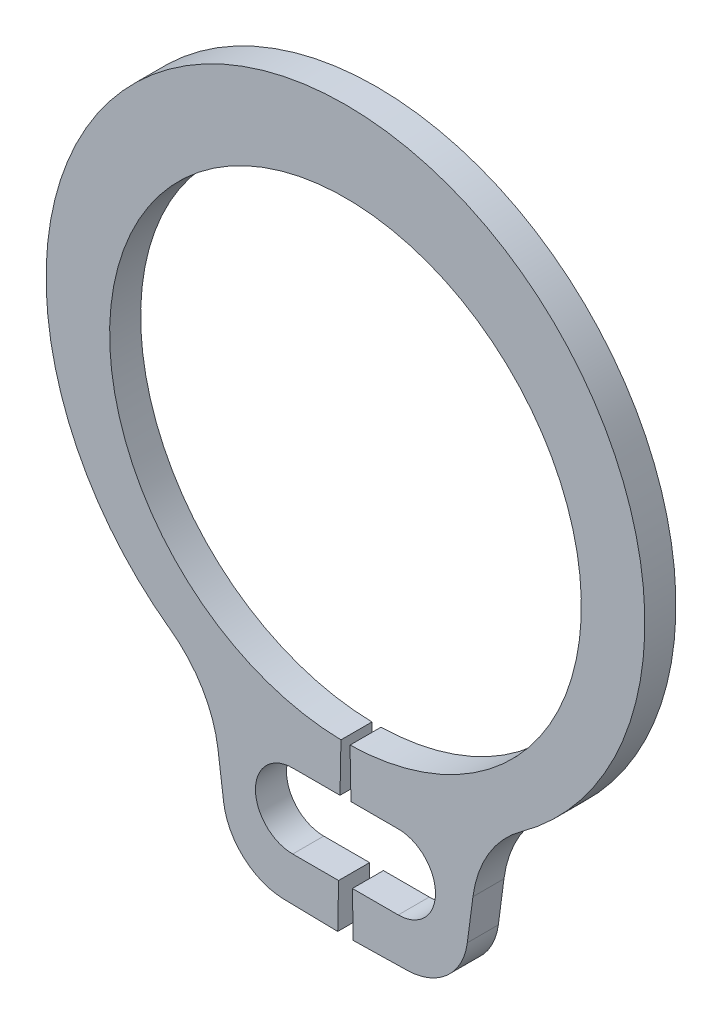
SolidWorks part; units mm, degrees
ref_plane "Plane1" through (0, 0, 0) normal (0, 0, 1) x (1, 0, 0)
ref_plane "Plane2" through (0, 0, 0) normal (0, 1, 0) x (1, 0, 0)
ref_plane "Plane3" through (0, 0, 0) normal (1, 0, 0) x (0, 0, -1)
extrude "Body" add sketch "BodySke" against normal blind 0.25
sketch "BodySke" plane through (0, 0, 0) normal (0, 0, 1) x (1, 0, 0)
  line L0 (-1.5431, 0) -> (1.5431, 0) construction
  line L1 (0, 0) -> (0, 2.55) construction
  line L2 (0.0365, -1.8996) -> (0.0625, -3.2494)
  line L3 (-0.0365, -1.8996) -> (-0.0625, -3.2494)
  line L4 (0, 0) -> (1.9681, -2.5863) construction
  line L5 (0, 0) -> (-1.9681, -2.5863) construction
  line L6 (0.0625, -3.2494) -> (0.4952, -3.2411)
  line L7 (1.0266, -2.4624) -> (0.9813, -2.8064)
  line L8 (-1.0266, -2.4624) -> (-0.9813, -2.8064)
  line L9 (-0.0625, -3.2494) -> (-0.4952, -3.2411)
  circle A0 centre (0, 0) radius 1.9 construction
  arc A1 (0.0365, -1.8996) -> (-0.0365, -1.8996) centre (0, 0) ccw
  arc A2 (1.3928, -1.8303) -> (-1.3928, -1.8303) centre (0, 0.1384) ccw construction
  arc A3 (0.0625, -3.2494) -> (0.8139, -3.1464) centre (0, 0) ccw construction
  arc A4 (1.4121, -1.8165) -> (1.0266, -2.4624) centre (1.9681, -2.5863) ccw
  arc A5 (-1.0266, -2.4624) -> (-1.4121, -1.8165) centre (-1.9681, -2.5863) ccw
  arc A6 (-0.8139, -3.1464) -> (-0.0625, -3.2494) centre (0, 0) ccw construction
  arc A7 (1.4121, -1.8165) -> (-1.4121, -1.8165) centre (0, 0.1384) ccw
  arc A8 (-1.0331, -2.4131) -> (1.0331, -2.4131) centre (0, 0) ccw construction
  circle A9 centre (0.425, -2.5904) radius 0.3
  circle A10 centre (-0.425, -2.5904) radius 0.3
  arc A11 (0.9813, -2.8064) -> (0.4952, -3.2411) centre (0.4856, -2.7412) cw
  arc A12 (-0.9813, -2.8064) -> (-0.4952, -3.2411) centre (-0.4856, -2.7412) ccw
  point P28 (0.9413, -3.1107)
  point P31 (-0.9413, -3.1107)
  dimension "GrooveDia" = 3.8
  dimension "D3" = 0.5
  dimension "LugRad" = 3.25
  dimension "HoleOffsetRad" = 2.625
  dimension "HoleDia" = 0.6
  dimension "D2" = 15
  dimension "LargeRad" = 2.55
  dimension "SmallRad" = 2.3
  dimension "Gap" = 0.125
  dimension "SmallAngle" = 74.54
  dimension "HoleSpacing" = 0.85
sketch "Clipboard" plane through (0, 0, 0) normal (0, 0, 1) x (1, 0, 0)
  line L0 (0, 0) -> (0.65, 0)
  line L1 (0, 0) -> (0, 0.4)
  line L2 (0, 0) -> (0, -1.35)
  circle A0 centre (0, 0) radius 0.3
  circle A1 centre (0, 0) radius 2
  dimension "HoleDia" = 0.6
  dimension "ShaftDia" = 4
  dimension "LargeSection" = 0.65
  dimension "SmallSection" = 0.4
  dimension "LugSection" = 1.35
sketch "NotSke" plane through (0, 0, 0) normal (0, 0, 1) x (1, 0, 0)
  line L0 (0.425, -2.2904) -> (0.425, -2.8904)
  line L1 (0.425, -2.8904) -> (-0.425, -2.8904)
  line L2 (-0.425, -2.8904) -> (-0.425, -2.2904)
  line L3 (-0.425, -2.2904) -> (0.425, -2.2904)
  circle A0 centre (0.425, -2.5904) radius 0.3 construction
  circle A1 centre (-0.425, -2.5904) radius 0.3 construction
extrude "Notch" cut sketch "NotSke" against normal through all
equation "' \"ShaftDia@Clipboard\" = 4"
equation "' \"Thickness@Body\" = 0.25"
equation "' \"GrooveDia@BodySke\" = 3.8"
equation "' \"LugSection@Clipboard\" = 1.35"
equation "' \"LargeSection@Clipboard\" = 0.65"
equation "' \"SmallSection@Clipboard\" = 0.4"
equation "' \"HoleDia@Clipboard\" = 0.6"
equation "' \"ShaftDia@Clipboard\" = 15"
equation "' \"Thickness@Body\" = 0.9"
equation "' \"GrooveDia@BodySke\" = 14.15"
equation "' \"LugSection@Clipboard\" = 2.8"
equation "' \"LargeSection@Clipboard\" = 1.8"
equation "' \"SmallSection@Clipboard\" = 1.05"
equation "' \"HoleDia@Clipboard\" = 1.2"
equation "\"Gap@BodySke\" =  \"Thickness@Body\" / 2"
equation "\"LargeRad@BodySke\" =  \"GrooveDia@BodySke\" / 2 +  \"LargeSection@Clipboard\""
equation "\"SmallRad@BodySke\" =  \"GrooveDia@BodySke\" / 2 +  \"SmallSection@Clipboard\""
equation "\"LugRad@BodySke\" = \"GrooveDia@BodySke\" / 2 + \"LugSection@Clipboard\""
equation "\"HoleOffsetRad@BodySke\" = (  \"ShaftDia@Clipboard\" / 2 + \"LugRad@BodySke\" ) / 2"
equation "\"HoleSpacing@BodySke\" = \"Gap@BodySke\"  * 2 +  \"HoleDia@Clipboard\""
equation "\"HoleDia@BodySke\" =  \"HoleDia@Clipboard\""
equation "\"SmallAngle@BodySke\" = atn(\"HoleSpacing@BodySke\" / 2 / sqr(\"HoleOffsetRad@BodySke\"  * \"HoleOffsetRad@BodySke\" - (\"HoleSpacing@BodySke\" / 2) * (\"HoleSpacing@BodySke\" / 2) ))  * 8 * ( 180 / 3.141593)"
